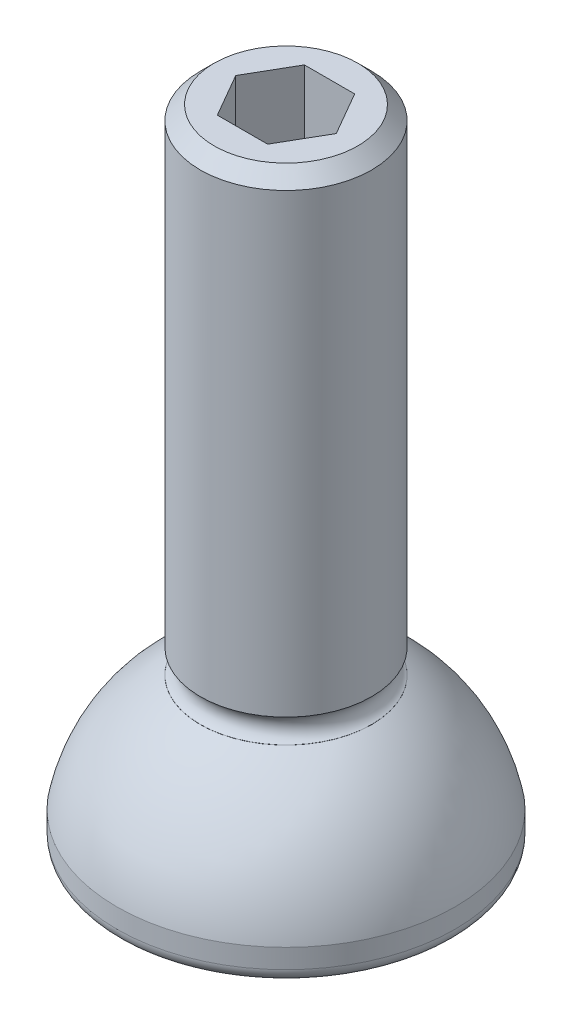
SolidWorks part; units mm, degrees
ref_plane "Front Plane" through (0, 0, 0) normal (0, 0, 1) x (1, 0, 0)
ref_plane "Top Plane" through (0, 0, 0) normal (0, 1, 0) x (1, 0, 0)
ref_plane "Right Plane" through (0, 0, 0) normal (1, 0, 0) x (0, 0, -1)
sketch "Sketch1" plane through (0, 0, 0) normal (0, 0, 1) x (1, 0, 0)
  line L0 (0, -1000) -> (0, 49000) construction
  line L1 (0, 0) -> (9.271, 0)
  line L2 (55, 0) -> (-55, 0) construction
  line L3 (9.271, 0) -> (9.271, 1.8244)
  line L5 (4.699, 8.1975) -> (4.699, 35.306)
  line L6 (4.699, 35.306) -> (0, 35.306)
  line L7 (0, 35.306) -> (0, 0)
  arc A0 (9.271, 1.8244) -> (4.699, 8.1975) centre (0, 0) ccw
  dimension "D4" = 9.4488
  dimension "D1" = 35.306
  dimension "D2" = 9.398
  dimension "D3" = 18.542
revolve "Revolve1" add sketch "Sketch1" angle 360 about L0
chamfer "Chamfer1" distance 0.762 angle 45 1 edges at (4.699, 35.306, 0)
fillet "Fillet1" radius 0.762 1 edges at (9.271, 0, 0)
hole_wizard "Hole1" positions "3DSketch1" profile "Sketch7" legacy
sketch3d "3DSketch1"
  line L0 (0, 34.544, 0) -> (0, 35.306, 0) construction
  point P0 (17.7172, 0, -13.1596)
  point P2 (0, 35.306, 0)
sketch "Sketch7" plane through (0, 35.306, 0) normal (1, 0, 0) x (0, 0, 1)
  line L0 (0, 0) -> (0, 7.7846)
  line L1 (0, 7.7846) -> (2.3876, 6.35)
  line L2 (2.3876, 6.35) -> (2.3876, 0)
  line L4 (2.3876, 0) -> (0, 0)
  line L6 (0, 7.7846) -> (-2.3876, 6.35) construction
  line L7 (0, -4.2442) -> (0, 117.3081) construction
  dimension "Diameter" = 4.7752
  dimension "Depth" = 6.35
  dimension "Drill Angle" = 118
sketch "Sketch4" plane through (0, 35.306, 0) normal (0, 1, 0) x (1, 0, 0)
  line L1 (1.3785, 2.3876) -> (-1.3785, 2.3876)
  line L2 (-1.3785, 2.3876) -> (-2.757, 0)
  line L3 (-2.757, 0) -> (-1.3785, -2.3876)
  line L4 (-1.3785, -2.3876) -> (1.3785, -2.3876)
  line L5 (1.3785, -2.3876) -> (2.757, 0)
  line L6 (2.757, 0) -> (1.3785, 2.3876)
  circle A0 centre (0, 0) radius 2.3876 construction
  dimension "D1" = 4.7752
extrude "Cut-Extrude1" cut sketch "Sketch4" against normal blind 4.826
sketch "Sketch5" plane through (0, 0, 0) normal (0, 0, 1) x (1, 0, 0)
  line L0 (10.1981, 0) -> (-10.1981, 0) construction
  line L1 (0, -10.1981) -> (0, 10.1981) construction
  line L2 (0, -1000) -> (0, 49000) construction
  circle A0 centre (5.08, 8.8646) radius 0.762
  dimension "D3" = 1.524
  dimension "D1" = 8.8646
  dimension "D2" = 5.08
revolve "Cut-Revolve1" cut sketch "Sketch5" angle 360 about L2
